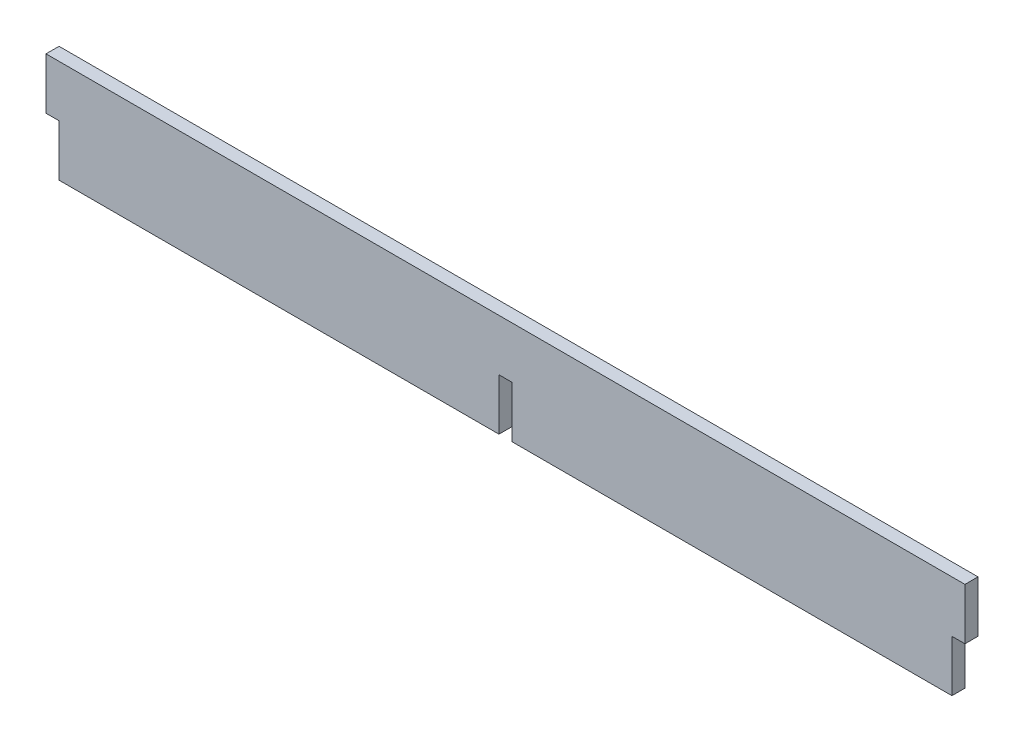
SolidWorks part; units mm, degrees
ref_plane "Front Plane" through (0, 0, 0) normal (0, 0, 1) x (1, 0, 0)
ref_plane "Top Plane" through (0, 0, 0) normal (0, 1, 0) x (1, 0, 0)
ref_plane "Right Plane" through (0, 0, 0) normal (1, 0, 0) x (0, 0, -1)
sketch "Sketch1" plane through (0, 0, 0) normal (0, 0, 1) x (1, 0, 0)
  line L0 (114.315, 1.865) -> (222.225, 1.865)
  line L1 (3.2, 1.865) -> (111.115, 1.865)
  line L2 (0, 14.49) -> (0, 27.115)
  line L3 (0, 27.115) -> (225.425, 27.115)
  line L4 (225.425, 14.49) -> (225.425, 27.115)
  line L7 (0, 14.49) -> (3.2, 14.49)
  line L8 (3.2, 1.865) -> (3.2, 14.49)
  line L10 (111.115, 1.865) -> (111.115, 14.49)
  line L11 (111.115, 14.49) -> (114.315, 14.49)
  line L12 (114.315, 1.865) -> (114.315, 14.49)
  line L15 (225.425, 14.49) -> (222.225, 14.49)
  line L16 (222.225, 1.865) -> (222.225, 14.49)
  dimension "D2" = 3.2
  dimension "D3" = 3.2
  dimension "D4" = 3.2
  dimension "D5" = 12.625
  dimension "D6" = 25.25
  dimension "D7" = 12.625
  dimension "D8" = 12.625
  dimension "D9" = 107.915
extrude "Boss-Extrude1" add sketch "Sketch1" along normal blind 3.2 contours L3 L4 L15 L16 L0 L12 L11 L10 L1 L8 L7 L2
